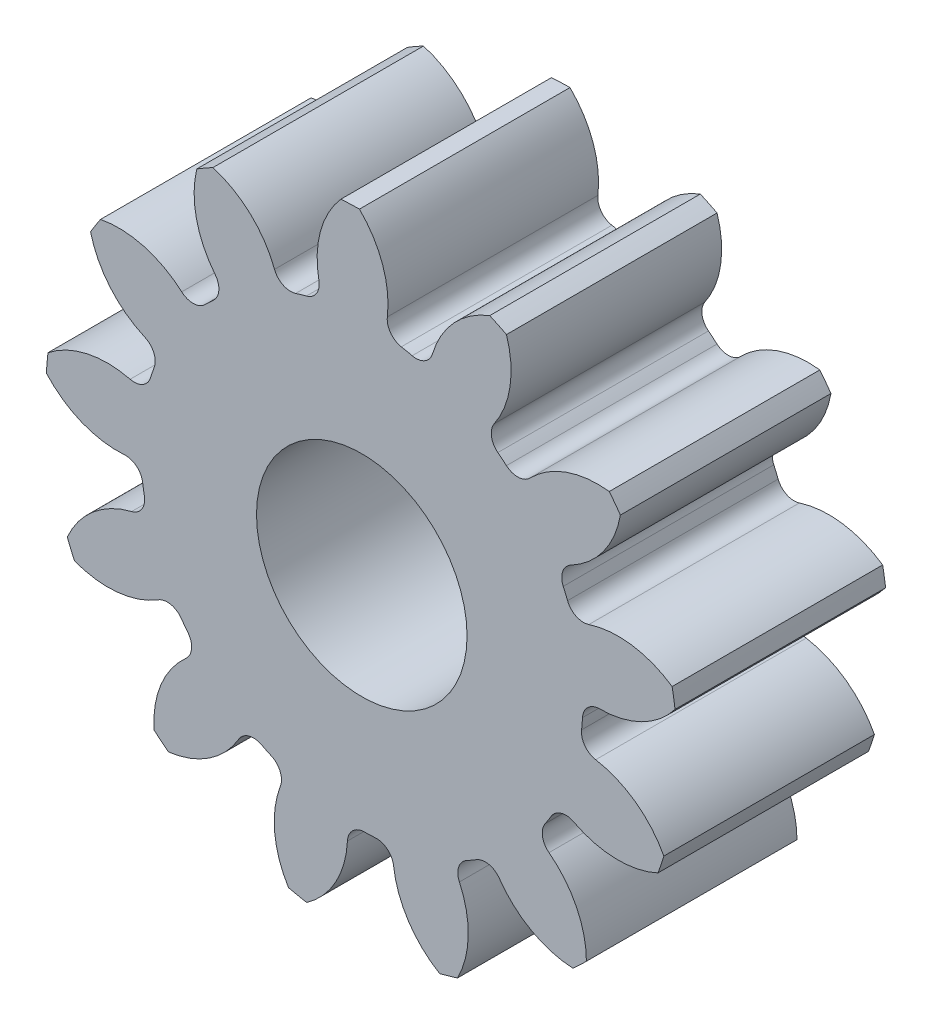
SolidWorks part; units mm, degrees
ref_plane "Front" through (0, 0, 0) normal (0, 0, 1) x (1, 0, 0)
ref_plane "Top" through (0, 0, 0) normal (0, 1, 0) x (1, 0, 0)
ref_plane "Right" through (0, 0, 0) normal (1, 0, 0) x (0, 0, -1)
sketch "Sketch3" plane through (0, 0, 0) normal (0, 0, 1) x (1, 0, 0)
  circle A0 centre (0, 0) radius 152.4
  dimension "od" = 304.8
extrude "gearBody" add sketch "Sketch3" along normal blind 101.6
sketch "Sketch2" plane through (0, 0, 0) normal (0, 0, 1) x (1, 0, 0)
  line L0 (0, 0) -> (114.6669, 47.4966) construction
  line L1 (146.709, -46.3877) -> (0, 0) construction
  line L2 (0, 0) -> (36.3143, 0) construction
  line L3 (131.9893, 4.8933) -> (129.3129, -26.8942) construction
  line L5 (130.6511, -11.0005) -> (0, 0) construction
  line L7 (0, 0) -> (124.1146, 0) construction
  arc A0 (124.0898, 2.482) -> (121.9278, -23.196) centre (0, 0) ccw construction
  arc A1 (151.1483, 19.4927) -> (145.761, -44.4916) centre (0, 0) ccw construction
  arc A2 (131.9893, 4.8933) -> (129.3129, -26.8942) centre (0, 0) ccw construction
  arc A3 (106.0455, -11.6181) -> (106.4952, -6.2772) centre (0, 0) ccw
  arc A4 (146.709, -46.3877) -> (112.871, -20.6704) centre (105.1107, -66.0013) ccw
  arc A5 (146.709, -46.3877) -> (152.4, 21.2036) centre (0, 0) ccw
  arc A6 (152.4, 21.2036) -> (114.7382, 1.5064) centre (114.6669, 47.4966) cw
  arc A7 (106.4952, -6.2772) -> (114.7382, 1.5064) centre (114.7511, -6.7639) cw
  arc A8 (112.871, -20.6704) -> (106.0455, -11.6181) centre (114.2665, -12.5188) cw
  point P6 (152.4, 21.2036)
  point P22 (146.709, -46.3877)
  dimension "baseDia" = 248.2292
  dimension "od" = 304.8
  dimension "pd" = 264.16
  dimension "rd" = 213.36
  dimension "rFillet" = 8.2702
  dimension "pointX" = 152.4
  dimension "pointY" = 21.2036
  dimension "CTT" = 31.7875
  dimension "flankCenterAngle" = 22.5
extrude "toothCut" cut sketch "Sketch2" along normal through all
pattern_circular "CirPattern1" count 13 over 360 about axis through (0, 0, 0) along (0, 0, 1) of "toothCut"
sketch "hub1Dia" plane through (0, 0, 0) normal (0, 0, -1) x (-1, 0, 0)
  circle A0 centre (0, 0) radius 12.7
  dimension "hub1Dia" = 25.4
sketch "hub2Dia" plane through (0, 0, 101.6) normal (0, 0, 1) x (1, 0, 0)
  circle A0 centre (0, 0) radius 12.7
  dimension "hub2dia" = 25.4
sketch "boreDia" plane through (0, 0, 0) normal (0, 0, 1) x (1, 0, 0)
  circle A0 centre (0, 0) radius 50.8
  dimension "boreDia" = 101.6
extrude "bore" cut sketch "boreDia" against normal mid plane 25400
